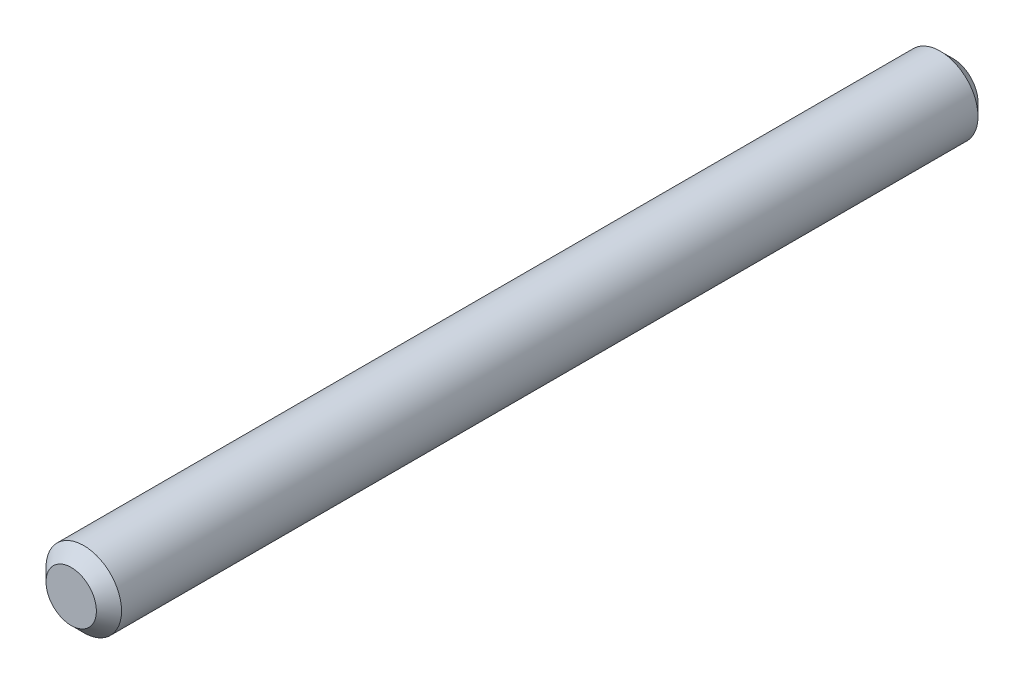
SolidWorks part; units mm, degrees
ref_plane "Plan de face" through (0, 0, 0) normal (0, 0, 1) x (1, 0, 0)
ref_plane "Plan de dessus" through (0, 0, 0) normal (0, 1, 0) x (1, 0, 0)
ref_plane "Plan de droite" through (0, 0, 0) normal (1, 0, 0) x (0, 0, -1)
sketch "Esquisse1" plane through (0, 0, 0) normal (0, 0, 1) x (1, 0, 0)
  circle A0 centre (0, 0) radius 1.5
extrude "Extrusion1" add sketch "Esquisse1" along normal blind 35
chamfer "Chanfrein1" distance 0.5 angle 45 2 edges at (1.5, 0, 0) (1.5, 0, 35)
